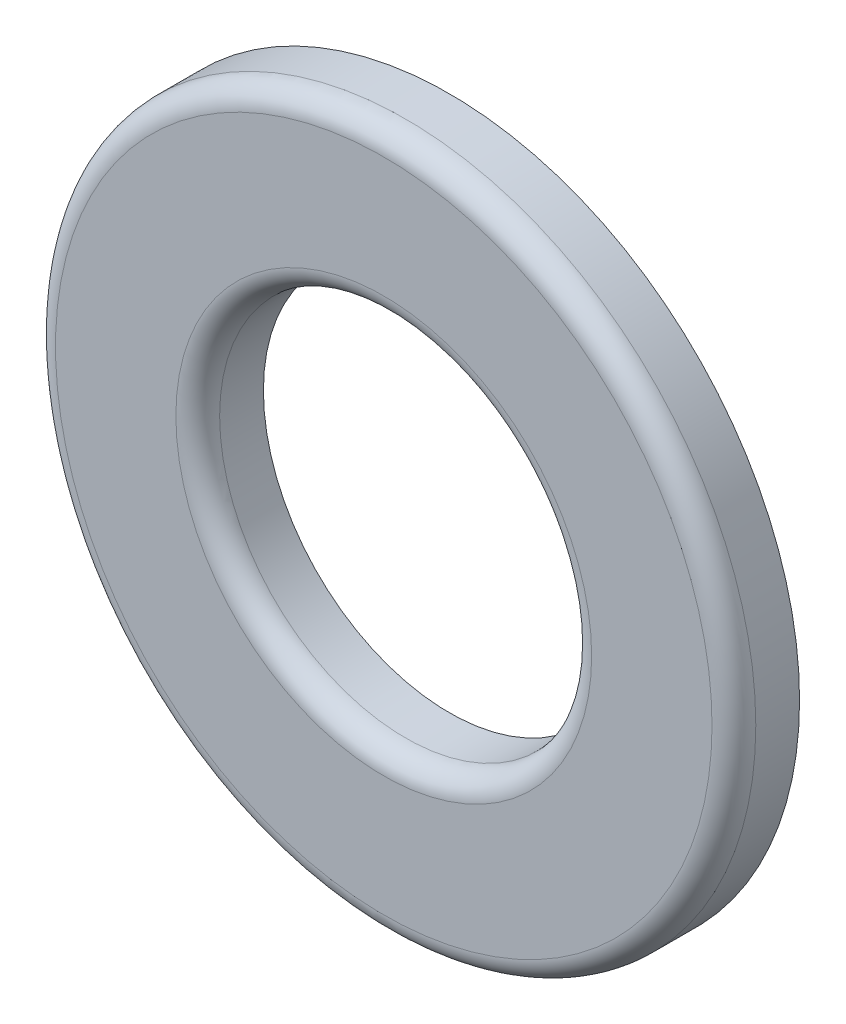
SolidWorks part; units mm, degrees
ref_plane "Plan1" through (0, 0, 0) normal (0, 0, 1) x (1, 0, 0)
ref_plane "Plan2" through (0, 0, 0) normal (0, 1, 0) x (1, 0, 0)
ref_plane "Plan3" through (0, 0, 0) normal (1, 0, 0) x (0, 0, -1)
sketch "Esquisse1" plane through (0, 0, 0) normal (0, 0, 1) x (1, 0, 0)
  circle A0 centre (0, 0) radius 4.25
  circle A1 centre (0, 0) radius 8
  dimension "D1" = 16
  dimension "D2" = 8.5
extrude "Base-Extrusion" add sketch "Esquisse1" along normal blind 1.5
fillet "Congé1" radius 0.5
